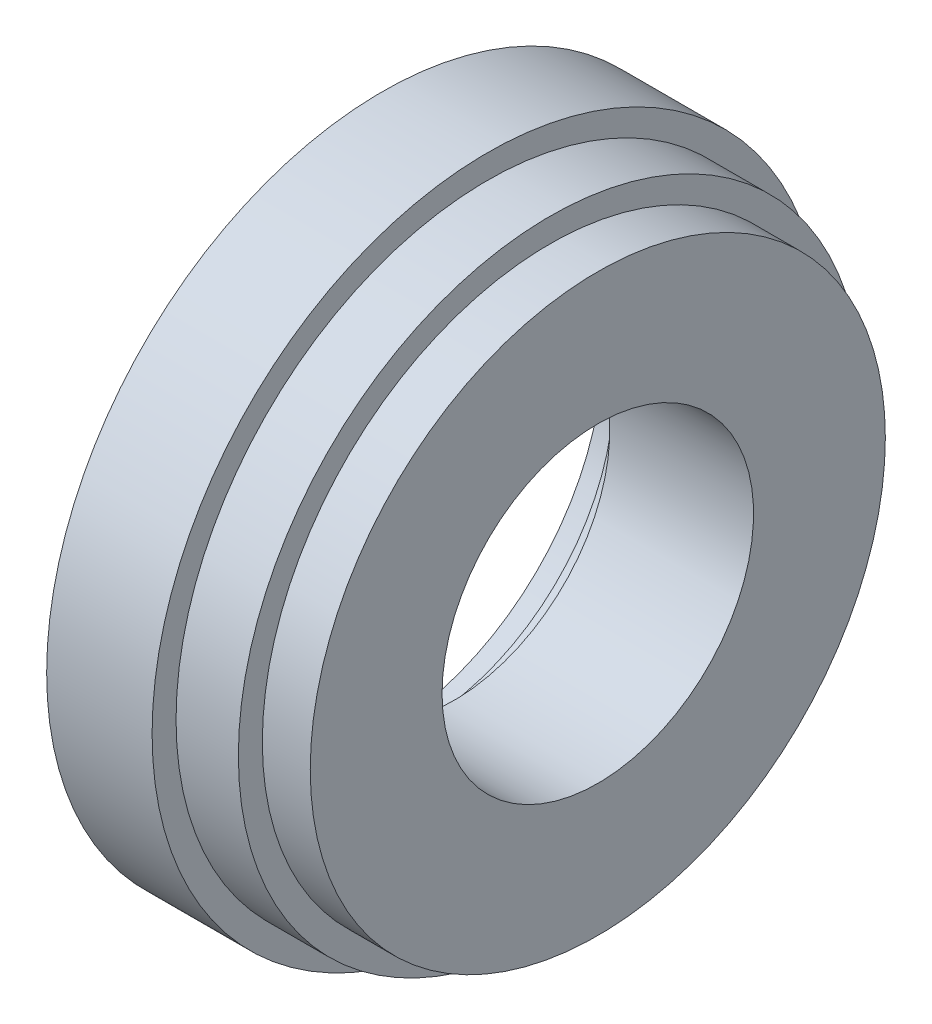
SolidWorks part; units mm, degrees
ref_plane "Plan1" through (0, 0, 0) normal (0, 0, 1) x (1, 0, 0)
ref_plane "Plan2" through (0, 0, 0) normal (0, 1, 0) x (1, 0, 0)
ref_plane "Plan3" through (0, 0, 0) normal (1, 0, 0) x (0, 0, -1)
sketch "Esquisse1" plane through (0, 0, 0) normal (0, 0, 1) x (1, 0, 0)
  line L0 (0, 46) -> (0, 70)
  line L1 (0, 70) -> (22, 70)
  line L2 (22, 65) -> (35, 65)
  line L3 (35, 60) -> (45, 60)
  line L4 (22, 70) -> (22, 65)
  line L5 (35, 60) -> (35, 65)
  line L6 (-4.4349, 0) -> (56.5452, 0) construction
  line L7 (8.3155, 40) -> (15, 40)
  line L8 (0, 46) -> (8.3155, 46)
  line L9 (8.3155, 46) -> (8.3155, 40)
  line L10 (15, 40) -> (15, 32.5)
  line L11 (45, 60) -> (45, 32.5)
  line L12 (15, 32.5) -> (45, 32.5)
  dimension "D1" = 70
  dimension "D2" = 22
  dimension "D3" = 35
  dimension "D4" = 40
  dimension "D5" = 46
  dimension "D6" = 30
  dimension "D7" = 45
  dimension "D8" = 65
  dimension "D9" = 60
revolve "Base-Révolution" add sketch "Esquisse1" angle 360 about L6
